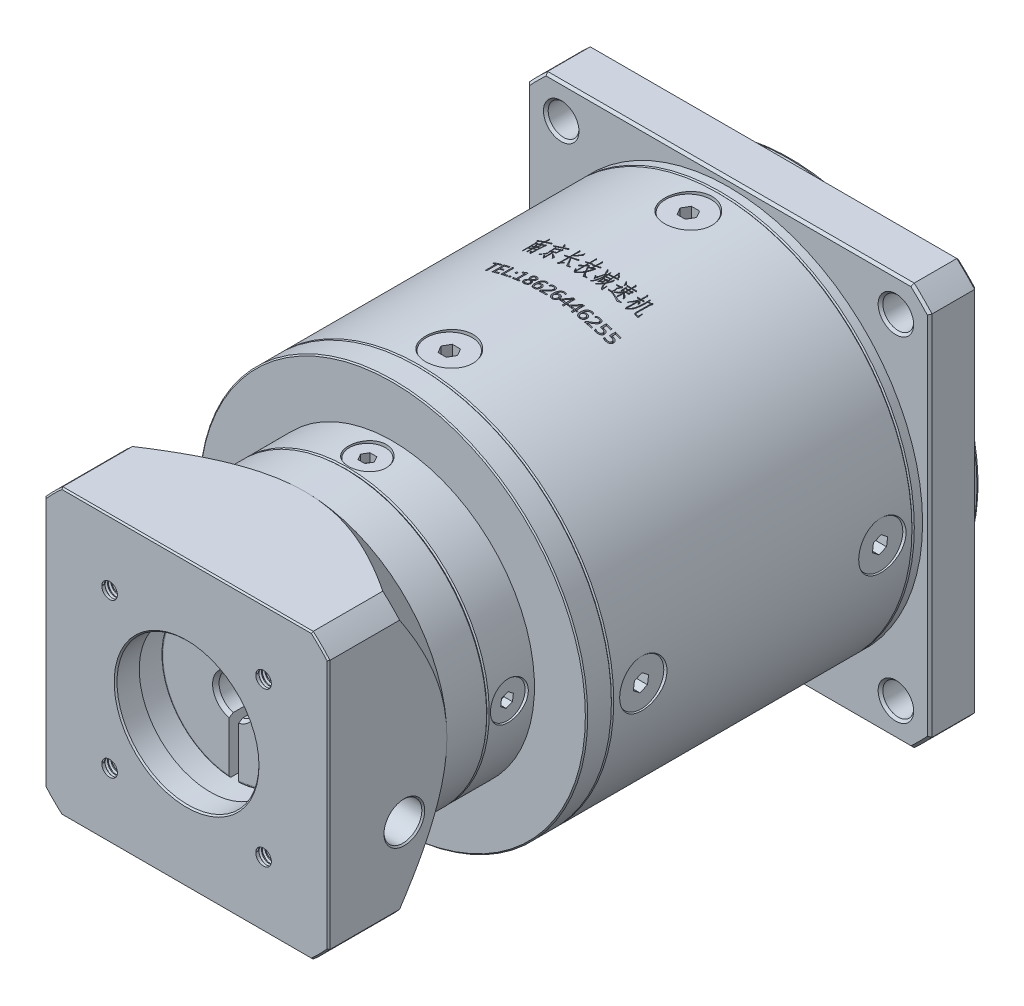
SolidWorks part; units mm, degrees
ref_plane "前视基准面" through (0, 0, 0) normal (0, 0, 1) x (1, 0, 0)
ref_plane "上视基准面" through (0, 0, 0) normal (0, 1, 0) x (1, 0, 0)
ref_plane "右视基准面" through (0, 0, 0) normal (1, 0, 0) x (0, 0, -1)
imported_body "8-30-46-M4-1-solid1"
imported_body "8-30-46-M4-1-solid2"
imported_body "8-30-46-M4-1-solid3"
imported_body "8-30-46-M4-1-solid4"
imported_body "8-30-46-M4-1-solid5"
imported_body "ZF80-K15-L3-F60-2-solid1"
imported_body "ZF80-K15-L3-F60-2-solid2"
imported_body "ZF80-K15-L3-F60-2-solid3"
imported_body "ZF80-K15-L3-F60-2-solid4"
imported_body "ZF80-K15-L3-F60-2-solid5"
imported_body "ZF80-K15-L3-F60-2-solid6"
imported_body "ZF80-K15-L3-F60-2-solid7"
imported_body "ZF80-K15-L3-F60-2-solid8"
imported_body "ZF80-K15-L3-F60-2-solid9"
imported_body "ZF80-K15-L3-F60-2-solid10"
imported_body "ZF80-K15-L3-F60-2-solid11"
imported_body "ZF80-K15-L3-F60-2-solid12"
imported_body "ZF80-K15-L3-F60-2-solid13"
sketch "草图1" plane through (0, 0, -70.099) normal (0, 0, -1) x (-1, 0, 0)
  circle A0 centre (63.7037, 21.4092) radius 11.0619
  dimension "D1" = 22.1239
extrude "凸台-拉伸1" add sketch "草图1" along normal blind 5
